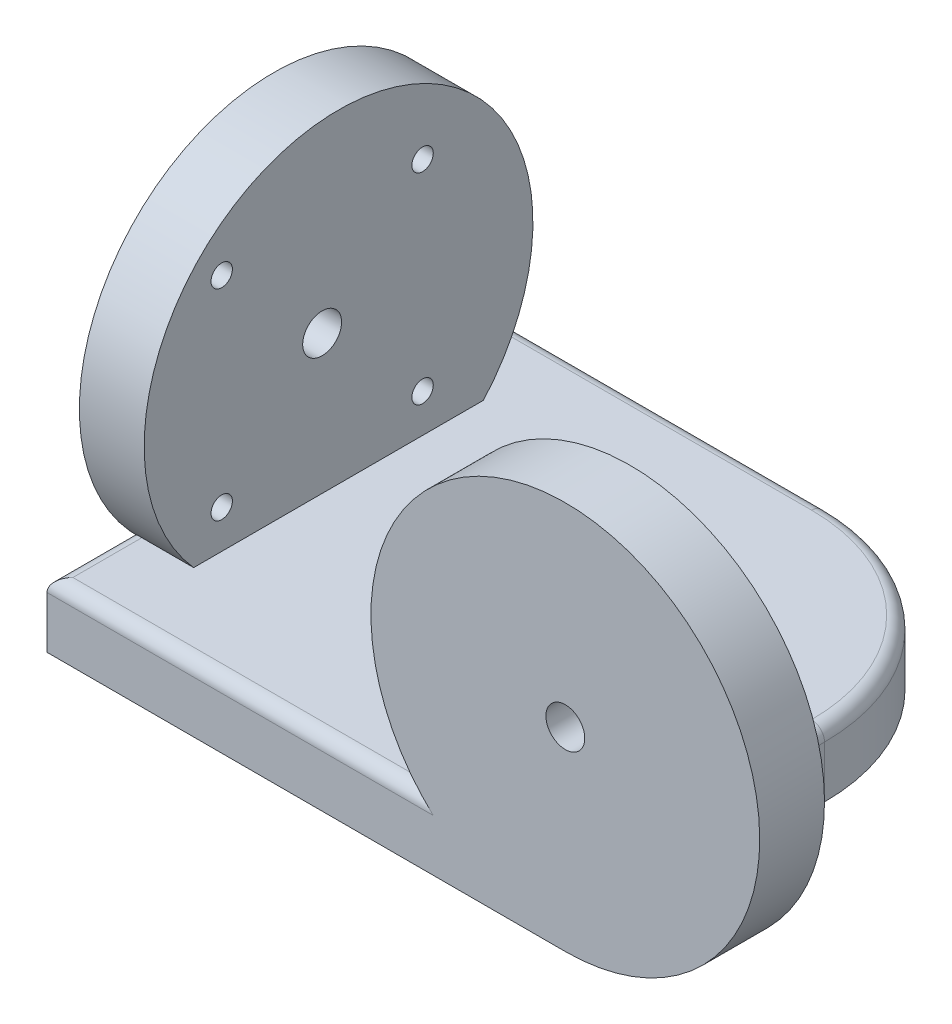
SolidWorks part; units mm, degrees
ref_plane "Front Plane" through (0, 0, 0) normal (0, 0, 1) x (1, 0, 0)
ref_plane "Top Plane" through (0, 0, 0) normal (0, 1, 0) x (1, 0, 0)
ref_plane "Right Plane" through (0, 0, 0) normal (1, 0, 0) x (0, 0, -1)
sketch "Sketch1" plane through (0, 0, 0) normal (0, 0, 1) x (1, 0, 0)
  circle A0 centre (0, 0) radius 30
  dimension "D1" = 60
extrude "Boss-Extrude1" add sketch "Sketch1" along normal blind 10
sketch "Sketch2" plane through (0, 0, 10) normal (0, 0, 1) x (1, 0, 0)
  line L1 (0, -30) -> (-80, -30)
  line L2 (0, -30) -> (0, -20)
  line L3 (0, -20) -> (-80, -20)
  line L4 (-80, -30) -> (-80, -20)
  circle A0 centre (0, 0) radius 30 construction
  dimension "D1" = 10
  dimension "D2" = 80
extrude "Boss-Extrude2" add sketch "Sketch2" against normal blind 70
sketch "Sketch3" plane through (-80, 0, 0) normal (-1, 0, 0) x (0, 0, 1)
  line L0 (-60, -30) -> (10, -30) construction
  line L1 (-60, -20) -> (10, -20) construction
  circle A0 centre (-25, 0) radius 30
  point P7 (-25, -20)
  dimension "D1" = 60
extrude "Boss-Extrude3" add sketch "Sketch3" against normal blind 10
hole_wizard "Ø6.0mm Dowel Hole2" positions "Sketch8" profile "Sketch9" hole size "Ø6.0" standard "ANSI Metric"
sketch "Sketch8" plane through (0, 0, 0) normal (0, 0, -1) x (-1, 0, 0)
  point P0 (0, 0)
sketch "Sketch9" plane through (0, 0, 0) normal (1, 0, 0) x (0, 1, 0)
  line L0 (0, 0) -> (0, 10)
  line L1 (0, 10) -> (3, 10)
  line L2 (3, 10) -> (3, 0)
  line L5 (3, 0) -> (0, 0)
  line L11 (0, -6.35) -> (0, 107.95) construction
  dimension "Thru Hole Dia." = 6
  dimension "Thru Hole Depth" = 10
hole_wizard "M4x0.7 Tapped Hole2" positions "Sketch10" profile "Sketch11" tap size "M4x0.7" standard "ANSI Metric"
sketch "Sketch10" plane through (0, 0, 0) normal (0, 0, -1) x (-1, 0, 0)
  point P0 (-15.5, 15.5)
  point P2 (15.5, 15.5)
  point P4 (15.5, -15.5)
  point P6 (-15.5, -15.5)
  dimension "D1" = 31
  dimension "D2" = 31
  dimension "D3" = 15.5
  dimension "D4" = 15.5
sketch "Sketch11" plane through (15.5, 15.5, 0) normal (1, 0, 0) x (0, 1, 0)
  line L0 (0, 0) -> (0, 6.9914)
  line L1 (0, 6.9914) -> (1.65, 6)
  line L2 (1.65, 6) -> (1.65, 0)
  line L5 (1.65, 0) -> (0, 0)
  line L10 (0, 6.9914) -> (-1.65, 6) construction
  line L11 (0, -6.35) -> (0, 107.95) construction
  dimension "Tap Drill Dia." = 3.3
  dimension "Tap Drill Depth" = 6
  dimension "Drill Angle" = 118
hole_wizard "Ø6.0mm Dowel Hole4" positions "Sketch19" profile "Sketch21" hole size "Ø6.0" standard "ANSI Metric"
sketch "Sketch19" plane through (-70, 1.4071, -22.469) normal (1, 0, 0) x (0, 0, -1)
  point P0 (0, 0)
sketch "Sketch21" plane through (-70, 1.4071, -22.469) normal (0, 1, 0) x (0, 0, -1)
  line L0 (0, 0) -> (0, 10)
  line L1 (0, 10) -> (3, 10)
  line L2 (3, 10) -> (3, 0)
  line L5 (3, 0) -> (0, 0)
  line L11 (0, -6.35) -> (0, 107.95) construction
  dimension "Thru Hole Dia." = 6
  dimension "Thru Hole Depth" = 10
hole_wizard "M4x0.7 Tapped Hole4" positions "Sketch23" profile "Sketch25" tap size "M4x0.7" standard "ANSI Metric"
sketch "Sketch23" plane through (-70, 1.4071, -22.469) normal (1, 0, 0) x (0, 0, -1)
  circle A0 centre (0, 0) radius 3 construction
  point P0 (-15.5, 15.5)
  point P2 (15.5, 15.5)
  point P4 (15.5, -15.5)
  point P6 (-15.5, -15.5)
  dimension "D1" = 31
  dimension "D2" = 31
  dimension "D3" = 15.5
  dimension "D4" = 15.5
sketch "Sketch25" plane through (-70, 16.9071, -6.969) normal (0, 1, 0) x (0, 0, -1)
  line L0 (0, 0) -> (0, 6.9914)
  line L1 (0, 6.9914) -> (1.65, 6)
  line L2 (1.65, 6) -> (1.65, 0)
  line L5 (1.65, 0) -> (0, 0)
  line L10 (0, 6.9914) -> (-1.65, 6) construction
  line L11 (0, -6.35) -> (0, 107.95) construction
  dimension "Tap Drill Dia." = 3.3
  dimension "Tap Drill Depth" = 6
  dimension "Drill Angle" = 118
fillet "Fillet1" radius 30 1 edges at (0, -25, -60)
fillet "Fillet2" radius 2 6 edges at (-51.1803, -20, 10) (-80, -20, -53.6803) (-80, -20, 3.6803) (-55, -20, -60) (-8.7868, -20, -51.2132) (0, -20, -15)
